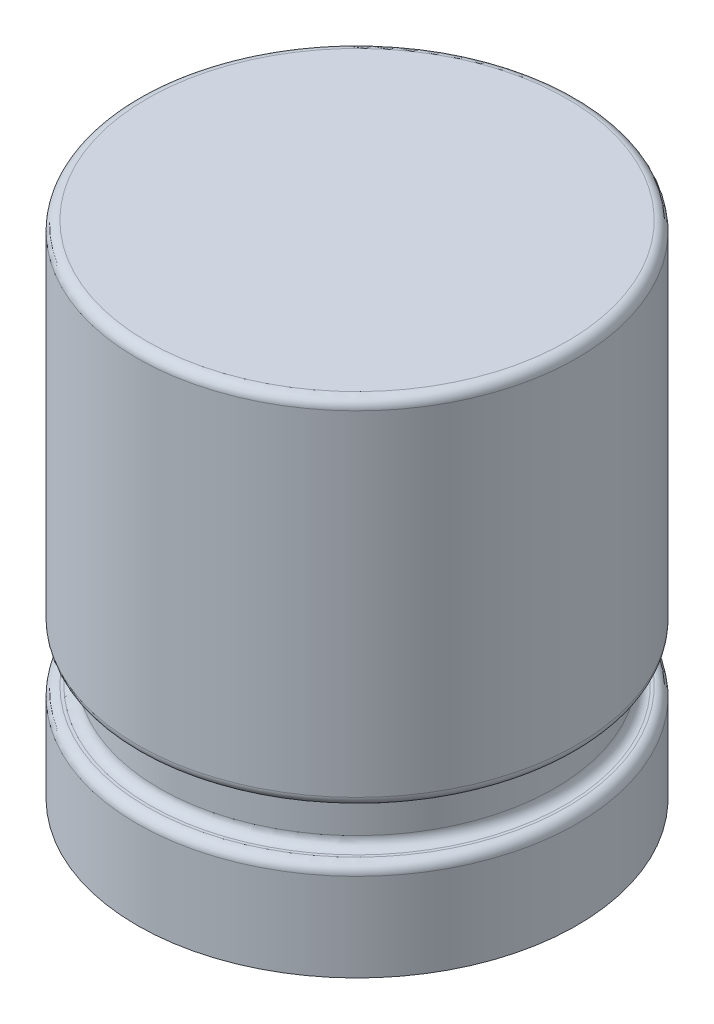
SolidWorks part; units mm, degrees
ref_plane "Alzado" through (0, 0, 0) normal (0, 0, 1) x (1, 0, 0)
ref_plane "Planta" through (0, 0, 0) normal (0, 1, 0) x (1, 0, 0)
ref_plane "Vista lateral" through (0, 0, 0) normal (1, 0, 0) x (0, 0, -1)
sketch "Croquis1" plane through (0, 0, 0) normal (0, 1, 0) x (1, 0, 0)
  circle A0 centre (0, 0) radius 1.8
extrude "Saliente-Extruir1" add sketch "Croquis1" along normal blind 0.8
sketch "Croquis2" plane through (0, 0.8, 0) normal (0, 1, 0) x (1, 0, 0)
  circle A0 centre (0, 0) radius 1.6173
extrude "Saliente-Extruir2" add sketch "Croquis2" along normal blind 0.4
sketch "Croquis3" plane through (0, 1.2, 0) normal (0, 1, 0) x (1, 0, 0)
  circle A0 centre (0, 0) radius 1.8
extrude "Saliente-Extruir3" add sketch "Croquis3" along normal blind 2.9
fillet "Redondeo3" radius 0.08 4 edges at (0, 0.8, 1.8) (0, 0.8, 1.6173) (0, 1.2, 1.8) (0, 1.2, 1.6173)
fillet "Redondeo4" radius 0.08 1 edges at (0, 4.1, 1.8)
